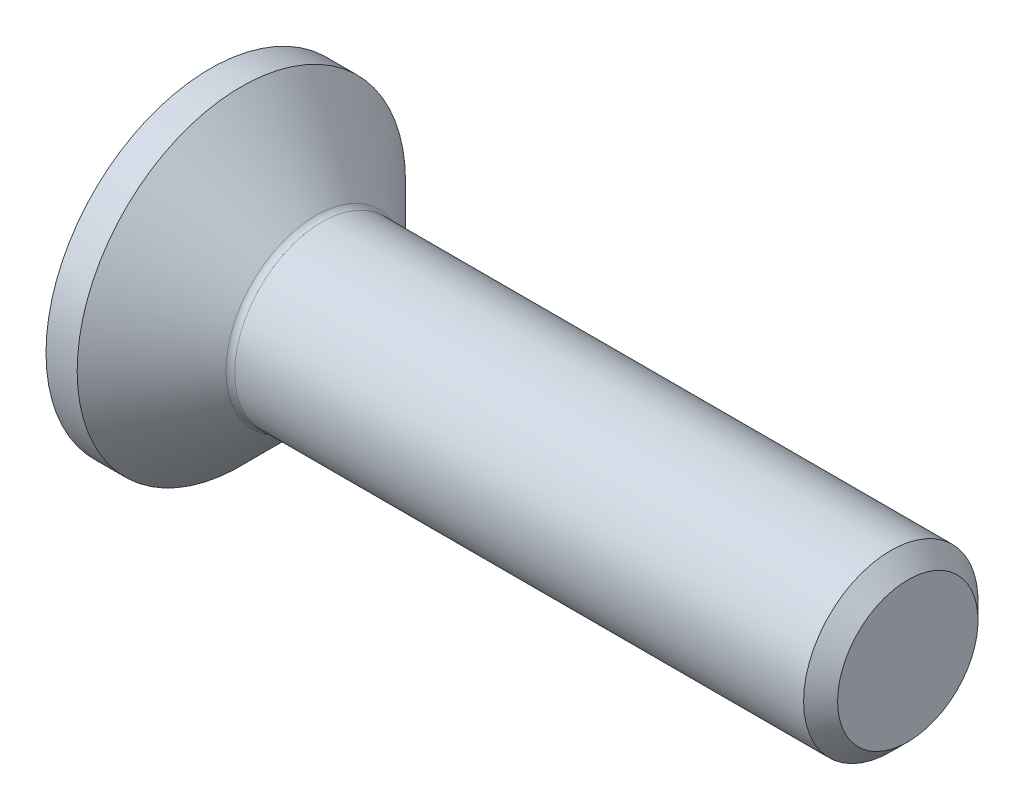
SolidWorks part; units mm, degrees
ref_plane "Plane1" through (0, 0, 0) normal (0, 0, 1) x (1, 0, 0)
ref_plane "Plane2" through (0, 0, 0) normal (0, 1, 0) x (1, 0, 0)
ref_plane "Plane3" through (0, 0, 0) normal (1, 0, 0) x (0, 0, -1)
sketch "BodySke" plane through (0, 0, 0) normal (0, 0, 1) x (1, 0, 0)
  line L0 (0, 0) -> (0, 3.765)
  line L1 (0.715, 3.765) -> (2.48, 2)
  line L2 (0, 3.765) -> (0.715, 3.765)
  line L3 (2.48, 2) -> (15.61, 2)
  line L4 (16, 1.61) -> (16, 0)
  line L5 (16, 0) -> (0, 0)
  line L6 (0, 0) -> (127, 0) construction
  line L7 (0.715, -3.765) -> (2.48, -2) construction
  line L8 (16, 1.61) -> (15.61, 2)
  line L9 (0, -3.765) -> (0.715, -3.765) construction
  line L10 (16, -1.61) -> (15.61, -2) construction
  line L11 (3.18, 8.35) -> (3.18, -13.875) construction
  line L12 (0, 19.05) -> (0, -3.175) construction
  dimension "D1" = 0.715
  dimension "Diameter" = 4
  dimension "Head_ht" = 2.48
  dimension "Length" = 16
  dimension "Body_ch_ang" = 45
  dimension "Head_dia" = 7.53
  dimension "Minor_dia" = 3.22
  dimension "Head_ang" = 90
  dimension "Advance" = 0.7
  dimension "Thread_nom" = 16
revolve "BaseBody" add sketch "BodySke"
fillet "Fillet1" radius 0.2 1 edges at (2.48, 0, 2)
sketch "Sketch2" plane through (0, 0, 0) normal (0, 0, 1) x (1, 0, 0)
  line L0 (0, 1.25) -> (1.5, 1.25)
  line L1 (1.5, 1.25) -> (2.2217, 0)
  line L2 (0, 0) -> (127, 0) construction
  line L3 (2.2217, 0) -> (0, 0)
  line L4 (0, 0) -> (0, 1.25)
  line L5 (0, -1.25) -> (1.5, -1.25) construction
  line L6 (0, 0) -> (47.625, 0) construction
  line L8 (0, 3.765) -> (0, -3.765) construction
  dimension "D2" = 60
  dimension "PreBroach_depth" = 1.5
  dimension "PreBroach_dia" = 2.5
revolve "PreBroach" cut sketch "Sketch2" angle 360 about L6
sketch "Sketch3" plane through (0, 0, 0) normal (-1, 0, 0) x (0, 0, 1)
  line L0 (-1.25, -0.7217) -> (-1.25, 0.7217)
  line L1 (-1.25, 0.7217) -> (0, 1.4434)
  line L2 (0, 1.4434) -> (1.25, 0.7217)
  line L3 (1.25, 0.7217) -> (1.25, -0.7217)
  line L4 (1.25, -0.7217) -> (0, -1.4434)
  line L5 (0, -1.4434) -> (-1.25, -0.7217)
  dimension "D1" = 1.25
  dimension "D2" = 1.25
  dimension "D3" = 2.5
  dimension "Hex_size" = 2.5
extrude "Hex" cut sketch "Sketch3" against normal blind 1.5
sketch "ThdSchSke" plane through (0, 0, 0) normal (0, 0, 1) x (1, 0, 0)
  line L0 (4.58, -1.61) -> (4.3069, -2)
  line L1 (4.58, -1.61) -> (4.8531, -2)
  line L2 (4.8531, -2) -> (4.8531, -2.5)
  line L3 (-3.175, 0) -> (5.1513, 0) construction
  line L4 (0, 3.765) -> (0, -3.765) construction
  line L5 (4.8531, -2.5) -> (4.3069, -2.5)
  line L6 (4.3069, -2.5) -> (4.3069, -2)
  dimension "Thread_minor" = 3.22
  dimension "Diameter" = 4
  dimension "Start" = 4.58
  dimension "SideAngle" = 55
  dimension "VeeAngle" = 70
  dimension "Overcut" = 5
revolve "ThreadSchematic" [suppressed] cut sketch "ThdSchSke" angle 360 about L3
pattern_linear "ThdSchPat" [suppressed]
equation "\"Thread_minor@ThreadCosmetic\"  =  \"Minor_dia@BodySke\""
equation "\"D1@Sketch3\" = \"Hex_size@Sketch3\" / 2"
equation "\"D2@Sketch3\" = \"D1@Sketch3\""
equation "\"D3@Sketch3\" = \"Hex_size@Sketch3\""
equation "\"Thread_length@ThreadCosmetic\" = ((sgn( (\"Length@BodySke\" - \"Advance@BodySke\" * 3.0 - \"Head_ht@BodySke\" ) - \"Thread_nom@BodySke\" )-1)*( (\"Length@BodySke\" - \"Advance@BodySke\" * 3.0 - \"Head_ht@BodySke\" "
equation "\"Thread_minor@ThdSchSke\" = \"Minor_dia@BodySke\""
equation "\"Diameter@ThdSchSke\" = \"Diameter@BodySke\""
equation "\"Overcut@ThdSchSke\" = \"Diameter@BodySke\" * 1.25"
equation "\"Start@ThdSchSke\" = 0.000001 + \"Length@BodySke\" - \"Thread_length@ThreadCosmetic\"  '---Countersunk---"
equation "\"Num_threads@ThdSchPat\" = int( \"Thread_length@ThreadCosmetic\" / \"Advance@BodySke\" + 0.999 )  + 1"
equation "\"Advance@ThdSchPat\" = \"Thread_length@ThreadCosmetic\" /  (\"Num_threads@ThdSchPat\" - 1) 'relax it"
equation "\"Num_threads@ThdSchPat\" = \"Num_threads@ThdSchPat\" - sgn( \"Num_threads@ThdSchPat\" - 1) '---chamfered tips only---"
